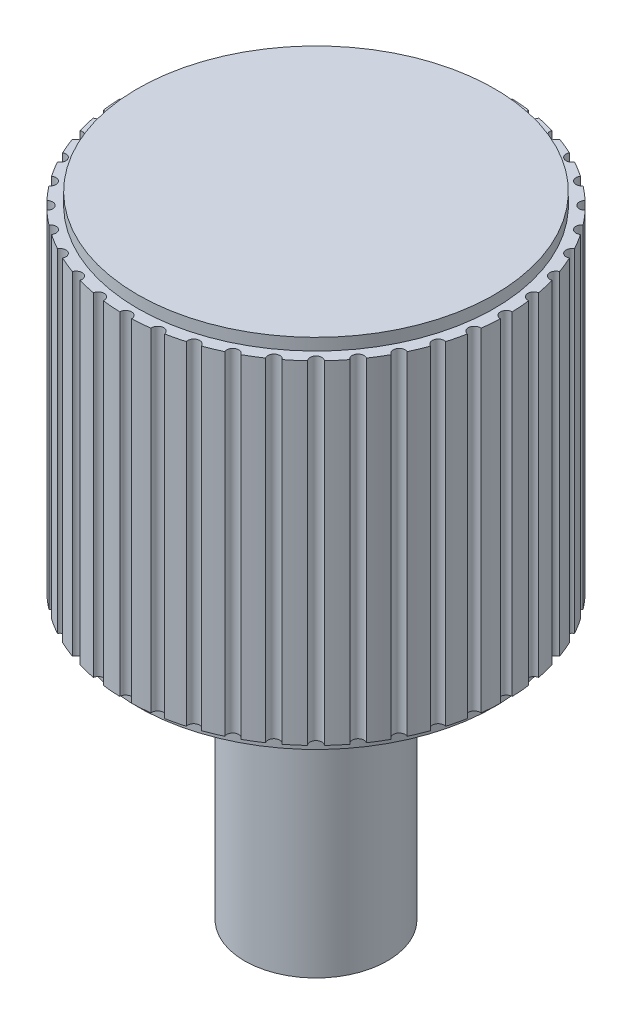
SolidWorks part; units mm, degrees
ref_plane "Front Plane" through (0, 0, 0) normal (0, 0, 1) x (1, 0, 0)
ref_plane "Top Plane" through (0, 0, 0) normal (0, 1, 0) x (1, 0, 0)
ref_plane "Right Plane" through (0, 0, 0) normal (1, 0, 0) x (0, 0, -1)
sketch "Sketch1" plane through (0, 0, 0) normal (0, 0, 1) x (1, 0, 0)
  line L0 (0, 2.9163) -> (0, -1.6319) construction
  line L1 (0, 0) -> (-0.6, 0)
  line L2 (-0.6, 0) -> (-0.6, 2.3)
  line L3 (-0.6, 2.3) -> (-1.6, 2.3)
  line L4 (-1.6, 2.3) -> (-1.6, 5.3)
  line L5 (-1.6, 5.3) -> (0, 5.3)
  line L6 (0, 5.3) -> (0, 0)
  dimension "D1" = 1.2
  dimension "D2" = 2.3
  dimension "D3" = 3
  dimension "D4" = 3.2
revolve "Revolve1" add sketch "Sketch1" angle 360 about L0
sketch "Sketch2" plane through (0, 5.3, 0) normal (0, 1, 0) x (1, 0, 0)
  circle A0 centre (0, 0) radius 1.5
  circle A1 centre (0, 0) radius 1.6
  circle A2 centre (0, 0) radius 1.6
  dimension "D1" = 0
  dimension "D2" = 0.1
extrude "Cut-Extrude1" cut sketch "Sketch2" against normal blind 0.1
sketch "Sketch3" plane through (0, 2.3, 0) normal (0, -1, 0) x (1, 0, 0)
  circle A0 centre (0, 0) radius 1.5
  circle A1 centre (0, 0) radius 1.6
  circle A2 centre (0, 0) radius 1.6
  dimension "D1" = 0
  dimension "D2" = 0.1
extrude "Cut-Extrude2" cut sketch "Sketch3" against normal blind 0.1
sketch "Sketch4" plane through (0, 5.3, 0) normal (0, 1, 0) x (1, 0, 0)
  line L0 (-1.2944, 0.9405) -> (0, 0) construction
  circle A0 centre (0, 1.6) radius 0.05
  circle A2 centre (0, 0) radius 1.6 construction
  circle A3 centre (0.2503, 1.5803) radius 0.05
  circle A4 centre (0.4944, 1.5217) radius 0.05
  circle A5 centre (0.7264, 1.4256) radius 0.05
  circle A6 centre (0.9405, 1.2944) radius 0.05
  circle A7 centre (1.1314, 1.1314) radius 0.05
  circle A8 centre (1.2944, 0.9405) radius 0.05
  circle A9 centre (1.4256, 0.7264) radius 0.05
  circle A10 centre (1.5217, 0.4944) radius 0.05
  circle A11 centre (1.5803, 0.2503) radius 0.05
  circle A12 centre (1.6, 0) radius 0.05
  circle A13 centre (1.5803, -0.2503) radius 0.05
  circle A14 centre (1.5217, -0.4944) radius 0.05
  circle A15 centre (1.4256, -0.7264) radius 0.05
  circle A16 centre (1.2944, -0.9405) radius 0.05
  circle A17 centre (1.1314, -1.1314) radius 0.05
  circle A18 centre (0.9405, -1.2944) radius 0.05
  circle A19 centre (0.7264, -1.4256) radius 0.05
  circle A20 centre (0.4944, -1.5217) radius 0.05
  circle A21 centre (0.2503, -1.5803) radius 0.05
  circle A22 centre (0, -1.6) radius 0.05
  circle A23 centre (-0.2503, -1.5803) radius 0.05
  circle A24 centre (-0.4944, -1.5217) radius 0.05
  circle A25 centre (-0.7264, -1.4256) radius 0.05
  circle A26 centre (-0.9405, -1.2944) radius 0.05
  circle A27 centre (-1.1314, -1.1314) radius 0.05
  circle A28 centre (-1.2944, -0.9405) radius 0.05
  circle A29 centre (-1.4256, -0.7264) radius 0.05
  circle A30 centre (-1.5217, -0.4944) radius 0.05
  circle A31 centre (-1.5803, -0.2503) radius 0.05
  circle A32 centre (-1.6, 0) radius 0.05
  circle A33 centre (-1.5803, 0.2503) radius 0.05
  circle A34 centre (-1.5217, 0.4944) radius 0.05
  circle A35 centre (-1.4256, 0.7264) radius 0.05
  circle A36 centre (-1.2944, 0.9405) radius 0.05
  circle A37 centre (-1.1314, 1.1314) radius 0.05
  circle A38 centre (-0.9405, 1.2944) radius 0.05
  circle A39 centre (-0.7264, 1.4256) radius 0.05
  circle A40 centre (-0.4944, 1.5217) radius 0.05
  circle A41 centre (-0.2503, 1.5803) radius 0.05
  circle A42 centre (0, 0) radius 1.6 construction
  point P84 (0, 0)
  dimension "D1" = 0.1
extrude "Cut-Extrude3" cut sketch "Sketch4" against normal through all
